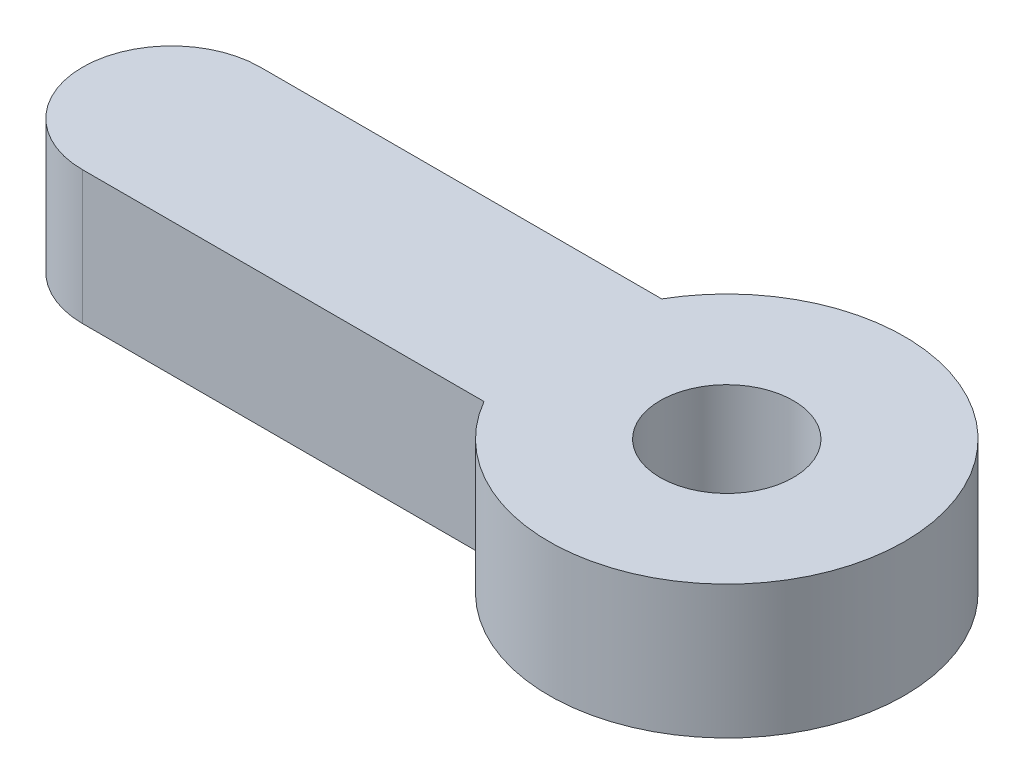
SolidWorks part; units mm, degrees
ref_plane "Front Plane" through (0, 0, 0) normal (0, 0, 1) x (1, 0, 0)
ref_plane "Top Plane" through (0, 0, 0) normal (0, 1, 0) x (1, 0, 0)
ref_plane "Right Plane" through (0, 0, 0) normal (1, 0, 0) x (0, 0, -1)
sketch "Sketch1" plane through (0, 0, 0) normal (0, 1, 0) x (1, 0, 0)
  line L0 (0, 0) -> (25, 0) construction
  line L1 (0, 4) -> (18.0718, 4)
  line L2 (0, -4) -> (18.0718, -4)
  arc A0 (0, 4) -> (0, -4) centre (0, 0) ccw
  circle A1 centre (25, 0) radius 3
  arc A2 (18.0718, -4) -> (18.0718, 4) centre (25, 0) ccw
  dimension "D1" = 8
  dimension "D2" = 6
  dimension "D3" = 16
  dimension "D4" = 25
extrude "Extrude1" add sketch "Sketch1" along normal blind 6
